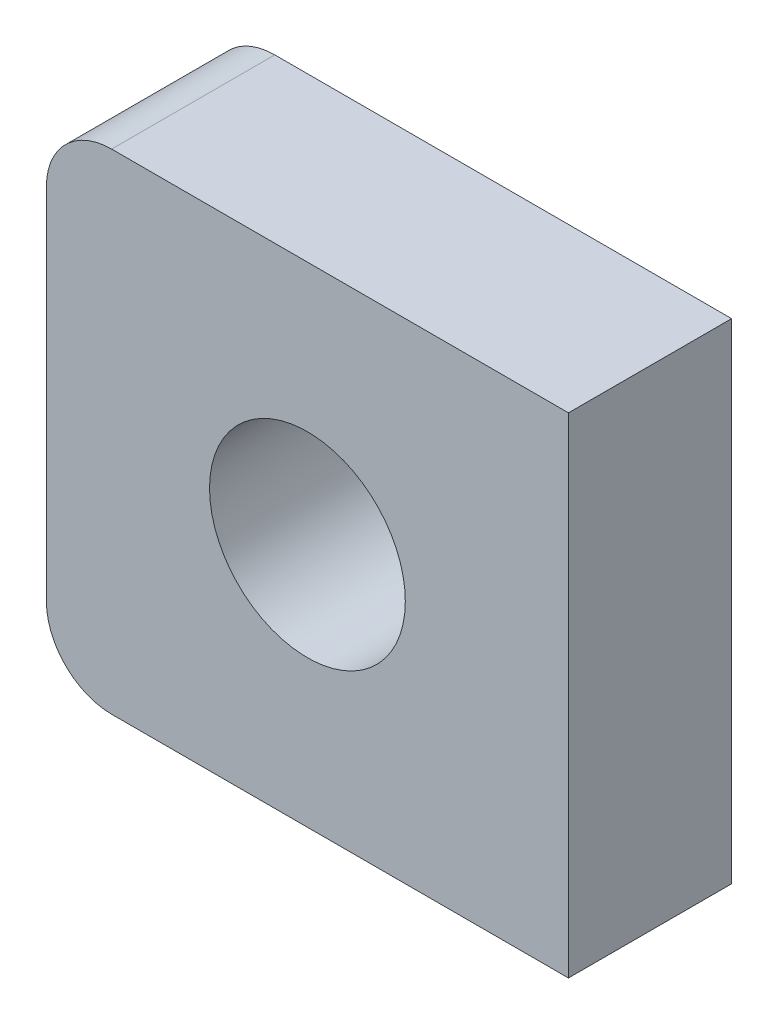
SolidWorks part; units mm, degrees
ref_plane "Plan de face" through (0, 0, 0) normal (0, 0, 1) x (1, 0, 0)
ref_plane "Plan de dessus" through (0, 0, 0) normal (0, 1, 0) x (1, 0, 0)
ref_plane "Plan de droite" through (0, 0, 0) normal (1, 0, 0) x (0, 0, -1)
sketch "Esquisse1" plane through (0, 0, 0) normal (0, 0, 1) x (1, 0, 0)
  line L0 (13, 0) -> (-2, 0) construction
  line L1 (-13, 7.5) -> (13, 7.5)
  line L2 (-13, 7.5) -> (-13, -7.5)
  line L3 (-13, -7.5) -> (13, -7.5)
  line L4 (13, 7.5) -> (13, -7.5)
  line L5 (-13, 7.5) -> (13, -7.5) construction
  line L6 (-13, -7.5) -> (13, 7.5) construction
  line L7 (-8, 0) -> (-13, 0) construction
  line L8 (8, -4.5) -> (8, -7.5) construction
  circle A0 centre (-5, 0) radius 3
  circle A1 centre (8, -2.5) radius 2
  point P0 (-5, 0)
  point P12 (0, 0)
  dimension "D3" = 6
  dimension "D5" = 4
  dimension "D1" = 5
  dimension "D2" = 15
  dimension "D4" = 15
  dimension "D6" = 3
  dimension "D7" = 5
extrude "Boss.-Extru.1" add sketch "Esquisse1" along normal blind 5
fillet "Congé1" radius 2 4 edges at (-13, -7.5, 2.5) (13, -7.5, 2.5) (13, 7.5, 2.5) (-13, 7.5, 2.5)
sketch "Esquisse2" plane through (0, 0, 5) normal (0, 0, 1) x (1, 0, 0)
  line L0 (-11, -7.5) -> (11, -7.5) construction
  line L1 (3, -7.5) -> (13, -7.5)
  line L2 (3, -7.5) -> (3, 7.5)
  line L3 (3, 7.5) -> (13, 7.5)
  line L4 (13, -7.5) -> (13, 7.5)
  line L5 (11, 7.5) -> (-11, 7.5) construction
  line L6 (13, -5.5) -> (13, 5.5) construction
  dimension "D1" = 10
extrude "Enlèv. mat.-Extru.1" cut sketch "Esquisse2" against normal through all both and the other way through all
